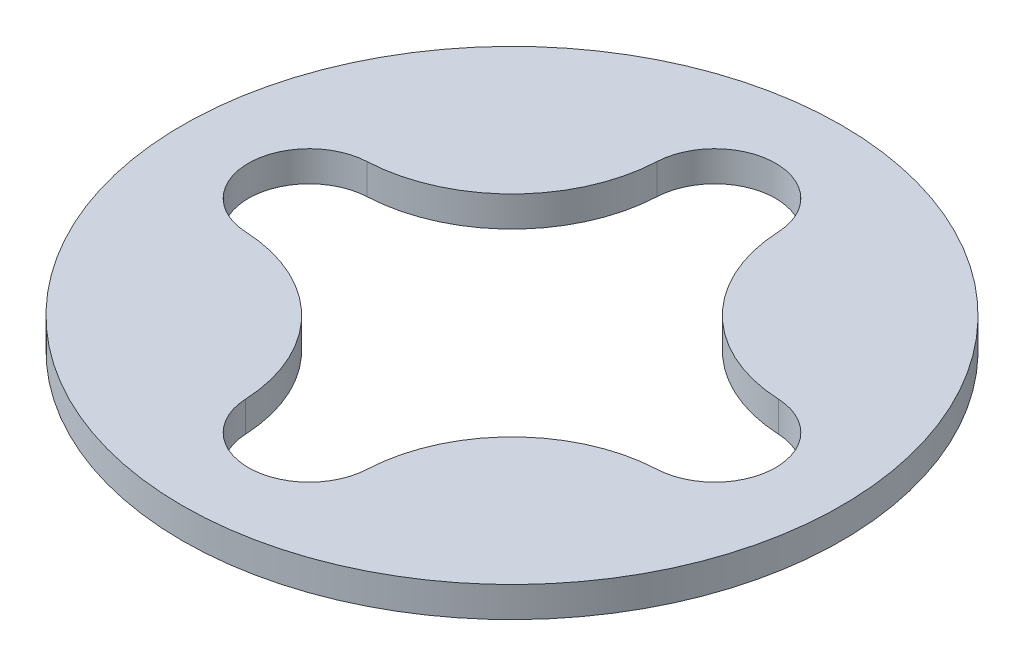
SolidWorks part; units mm, degrees
ref_plane "Front Plane" through (0, 0, 0) normal (0, 0, 1) x (1, 0, 0)
ref_plane "Top Plane" through (0, 0, 0) normal (0, 1, 0) x (1, 0, 0)
ref_plane "Right Plane" through (0, 0, 0) normal (1, 0, 0) x (0, 0, -1)
sketch "Sketch1" plane through (0, 0, 0) normal (0, 1, 0) x (1, 0, 0)
  line L0 (0, 32.5) -> (0, -32.5) construction
  line L1 (32.5, 0) -> (-32.5, 0) construction
  circle A0 centre (0, 0) radius 32.5
  circle A1 centre (0, 0) radius 20 construction
  arc A2 (20.2792, -5.9935) -> (20.2792, 5.9935) centre (20, 0) ccw
  arc A3 (5.9935, 20.2792) -> (-5.9935, 20.2792) centre (0, 20) ccw
  arc A4 (-20.2792, 5.9935) -> (-20.2792, -5.9935) centre (-20, 0) ccw
  arc A5 (-5.9935, -20.2792) -> (5.9935, -20.2792) centre (0, -20) ccw
  arc A6 (5.9935, 20.2792) -> (20.2792, 5.9935) centre (20.9772, 20.9772) ccw
  arc A7 (20.2792, -5.9935) -> (5.9935, -20.2792) centre (20.9772, -20.9772) ccw
  arc A8 (-5.9935, -20.2792) -> (-20.2792, -5.9935) centre (-20.9772, -20.9772) ccw
  arc A9 (-20.2792, 5.9935) -> (-5.9935, 20.2792) centre (-20.9772, 20.9772) ccw
  dimension "D3" = 65
  dimension "D1" = 40
  dimension "D2" = 12
  dimension "D4" = 30
extrude "Extrude1" add sketch "Sketch1" along normal blind 3
